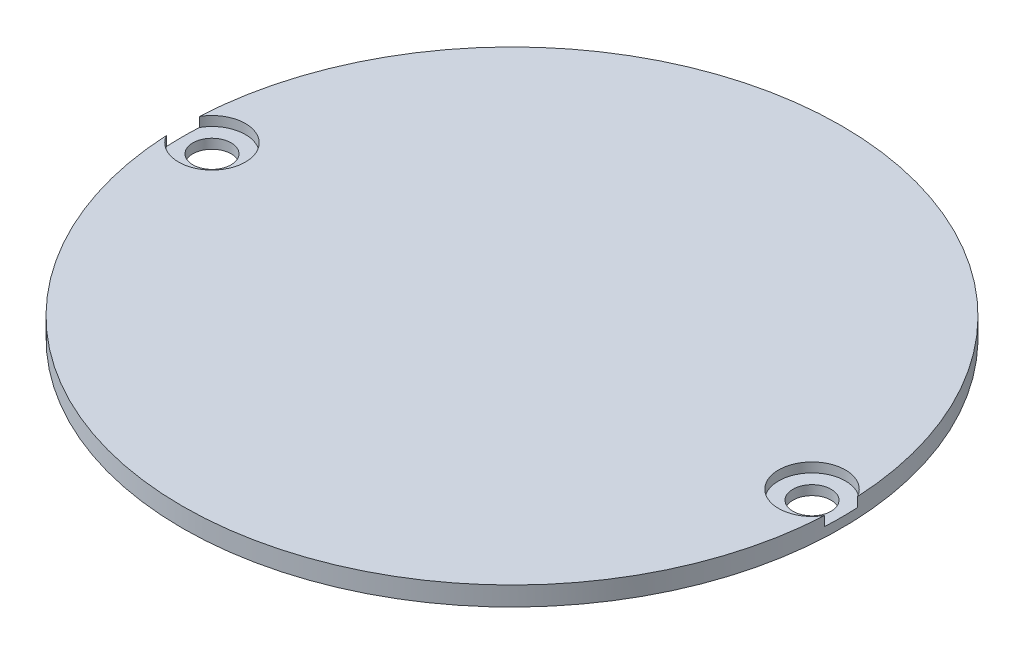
SolidWorks part; units mm, degrees
ref_plane "前视基准面" through (0, 0, 0) normal (0, 0, 1) x (1, 0, 0)
ref_plane "上视基准面" through (0, 0, 0) normal (0, 1, 0) x (1, 0, 0)
ref_plane "右视基准面" through (0, 0, 0) normal (1, 0, 0) x (0, 0, -1)
sketch "草图1" plane through (0, 0, 0) normal (0, 0, 1) x (1, 0, 0)
  line L0 (0, 0) -> (0, 62.0735) construction
  line L1 (0, 0) -> (-34.5, 0)
  dimension "D1" = 34.5
revolve "旋转-薄壁1" add sketch "草图1" angle 360 about L0
sketch "草图2" plane through (0, 2, 0) normal (0, 1, 0) x (1, 0, 0)
  line L0 (0, 0) -> (-31.41, 0) construction
  line L1 (0, 0) -> (0, 19.702) construction
  circle A1 centre (-31.41, 0) radius 2
  circle A2 centre (31.41, 0) radius 2
extrude "切除-拉伸1" cut sketch "草图2" against normal blind 10
sketch "草图3" plane through (0, 2, 0) normal (0, 1, 0) x (1, 0, 0)
  line L0 (0, 0) -> (0, 12.9445) construction
  circle A0 centre (-31.41, 0) radius 3.5
  circle A1 centre (31.41, 0) radius 3.5
extrude "切除-拉伸2" cut sketch "草图3" against normal blind 1
